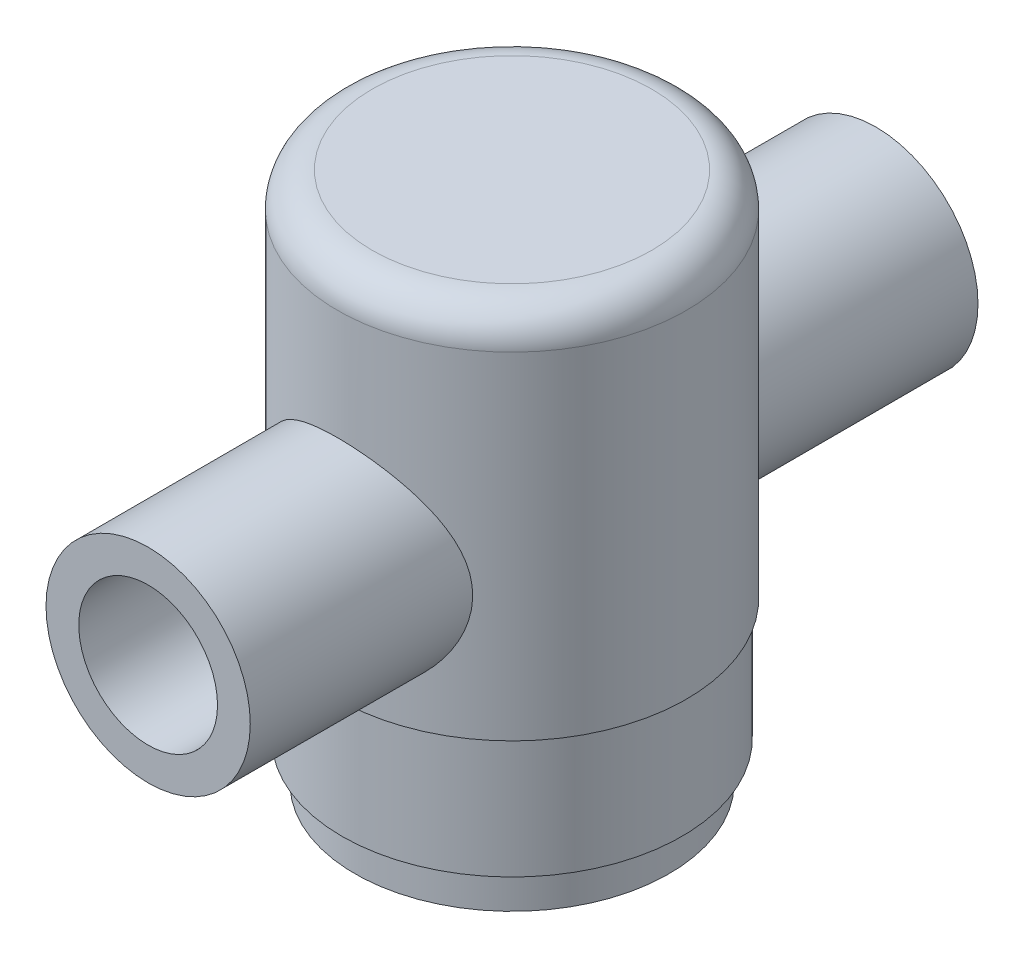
SolidWorks part; units mm, degrees
ref_plane "Front Plane" through (0, 0, 0) normal (0, 0, 1) x (1, 0, 0)
ref_plane "Top Plane" through (0, 0, 0) normal (0, 1, 0) x (1, 0, 0)
ref_plane "Right Plane" through (0, 0, 0) normal (1, 0, 0) x (0, 0, -1)
sketch "Sketch1" plane through (0, 0, 0) normal (0, 0, 1) x (1, 0, 0)
  line L0 (0, 0) -> (0, 92.1166) construction
  line L1 (-5.5626, 0) -> (-3.175, 2.3876) construction
  line L2 (-3.175, 5.4356) -> (-3.175, 27.6479)
  line L3 (-3.175, 27.6479) -> (0, 27.6479)
  line L4 (0, 27.6479) -> (0, 29.7434)
  line L5 (0, 29.7434) -> (-7.9819, 29.7434)
  line L6 (-7.9819, 12.7508) -> (-7.7778, 12.7508)
  line L7 (-7.9819, 29.7434) -> (-7.9819, 12.7508)
  line L8 (-7.9819, 12.7508) -> (-8.7948, 12.7508) construction
  line L9 (-8.7948, 12.7508) -> (-8.7947, 2.8448) construction
  line L10 (-8.7947, 2.8448) -> (-7.8994, 2.8448) construction
  line L11 (-7.8994, 2.8448) -> (-7.8994, 0) construction
  line L12 (-7.8994, 0) -> (-5.5626, 0) construction
  line L13 (-7.7778, 12.7508) -> (-7.7778, 7.2136)
  line L14 (-7.7778, 7.2136) -> (-7.1882, 7.2136)
  line L15 (-7.1882, 7.2136) -> (-7.1882, 5.4356)
  line L16 (-7.1882, 5.4356) -> (-3.175, 5.4356)
  line L17 (-3.175, 5.4356) -> (-3.175, 2.3876) construction
  dimension "D1" = 7.8994
  dimension "D2" = 6.35
  dimension "D3" = 8.7948
  dimension "D4" = 29.7434
  dimension "D5" = 15.9639
  dimension "D6" = 45
  dimension "D7" = 2.3368
  dimension "D8" = 9.906
  dimension "D9" = 12.7508
  dimension "D10" = 27.6479
  dimension "D11" = 24.3078
  dimension "D12" = 14.3764
  dimension "D13" = 1.778
revolve "Revolve1" add sketch "Sketch1" angle 360 about L0
fillet "Fillet1" radius 1.5875 1 edges at (0, 29.7434, -7.9819)
sketch "Sketch2" plane through (0, 0, 0) normal (0, 0, 1) x (1, 0, 0)
  line L0 (0, 23.114) -> (0, 0) construction
  circle A0 centre (0, 18.4404) radius 4.6736
  dimension "D1" = 9.3472
  dimension "D2" = 23.114
extrude "Boss-Extrude1" add sketch "Sketch2" along normal mid plane 33.2994
sketch "Sketch3" plane through (0, 0, 16.6497) normal (0, 0, 1) x (1, 0, 0)
  circle A0 centre (0, 18.4404) radius 0.7937
  dimension "D1" = 1.5875
extrude "Cut-Extrude1" cut sketch "Sketch3" against normal through all
sketch "Sketch4" [suppressed] plane through (0, 0, 0) normal (0, -1, 0) x (1, 0, 0)
  circle A0 centre (0, 0) radius 3.175
  dimension "D1" = 6.35
extrude "Cut-Extrude2" [suppressed] cut sketch "Sketch4" against normal up to surface (27.6479 mm away)
sketch "Sketch5" plane through (0, 0, 16.6497) normal (0, 0, 1) x (1, 0, 0)
  circle A0 centre (0, 18.4404) radius 3.175
  dimension "D1" = 6.35
extrude "Cut-Extrude3" cut sketch "Sketch5" against normal blind 8.128
sketch "Sketch6" plane through (0, 0, -16.6497) normal (0, 0, -1) x (-1, 0, 0)
  circle A0 centre (0, 18.4404) radius 3.175
  dimension "D1" = 6.35
extrude "Cut-Extrude4" cut sketch "Sketch6" against normal blind 8.128
